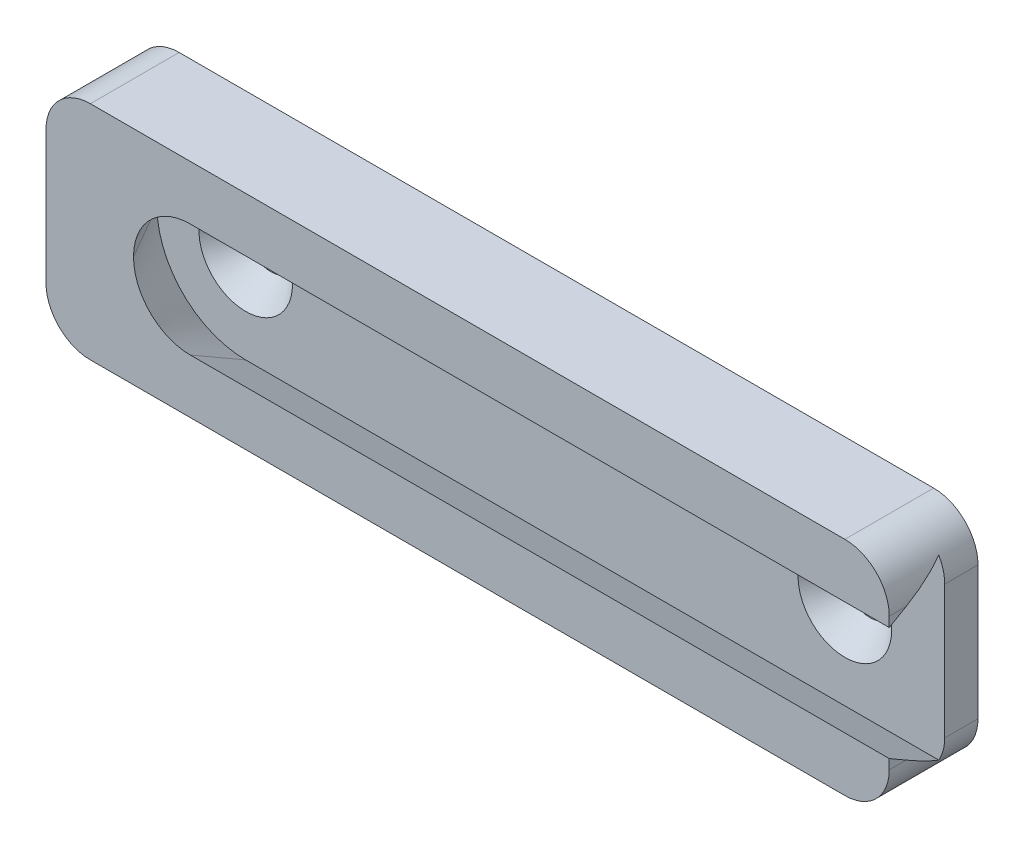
SolidWorks part; units mm, degrees
ref_plane "Front" through (0, 0, 0) normal (0, 0, 1) x (1, 0, 0)
ref_plane "Top" through (0, 0, 0) normal (0, 1, 0) x (1, 0, 0)
ref_plane "Right" through (0, 0, 0) normal (1, 0, 0) x (0, 0, -1)
sketch "Sketch1" plane through (0, 0, 0) normal (0, 0, 1) x (1, 0, 0)
  line L0 (0, 0) -> (-91.6833, 0) construction
  line L1 (-76, 10) -> (0, 10)
  line L2 (-76, 10) -> (-76, -10)
  line L3 (-76, -10) -> (0, -10)
  line L4 (0, 10) -> (0, -10)
  dimension "D1" = 20
  dimension "D2" = 76
extrude "Extrude1" add sketch "Sketch1" along normal blind 5
sketch "Sketch2" plane through (0, 0, 0) normal (0, 0, -1) x (-1, 0, 0)
  line L0 (0, -10) -> (0, 10) construction
  line L1 (0, 3) -> (66, 3)
  line L2 (0, 3) -> (0, -3)
  line L3 (0, -3) -> (66, -3)
  line L4 (66, 3) -> (66, -3)
  dimension "D1" = 6
  dimension "D2" = 66
extrude "Extrude2" cut sketch "Sketch2" against normal through all
fillet "Fillet1" radius 3 2 edges at (-66, -3, 2.5) (-66, 3, 2.5)
chamfer "Chamfer1" distance 5 angle 60 4 edges at (-31.5, -3, 0) (-65.1213, -2.1213, 0) (-65.1213, 2.1213, 0) (-31.5, 3, 0)
sketch "Sketch3" plane through (0, 0, 0) normal (0, 0, 1) x (1, 0, 0)
  line L1 (0, -10) -> (-76, -10)
  line L2 (0, -10) -> (0, 10)
  line L3 (0, 10) -> (-76, 10)
  line L4 (-76, -10) -> (-76, 10)
extrude "Extrude3" add sketch "Sketch3" against normal blind 3
fillet "Fillet2" radius 4 4 edges at (0, -10, 1) (0, 10, 1) (-76, -10, 1) (-76, 10, 1)
hole_wizard "CSK for #8 Flat Head Machine Screw1" positions "Sketch5" profile "Sketch4" countersink size "#8" standard "ANSI Inch"
sketch "Sketch5" plane through (0, 0, 0) normal (0, 0, 1) x (1, 0, 0)
  point P0 (-63, 0)
  point P3 (-9, 0)
  dimension "D1" = 54
sketch "Sketch4" plane through (-63, 0, 0) normal (1, 0, 0) x (0, -1, 0)
  line L0 (0, 0) -> (0, 3)
  line L1 (0, 3) -> (2.2479, 3)
  line L2 (2.2479, 3) -> (2.2479, 2.2645)
  line L3 (2.2479, 2.2645) -> (4.2164, 0)
  line L5 (4.2164, 0) -> (0, 0)
  line L6 (-2.2479, 2.2645) -> (-4.2164, 0) construction
  line L11 (0, -6.35) -> (0, 107.95) construction
  dimension "Thru Hole Dia." = 4.4958
  dimension "Thru Hole Depth" = 3
  dimension "Near C'Sink Dia." = 8.4328
  dimension "Near C'Sink Angle" = 82
